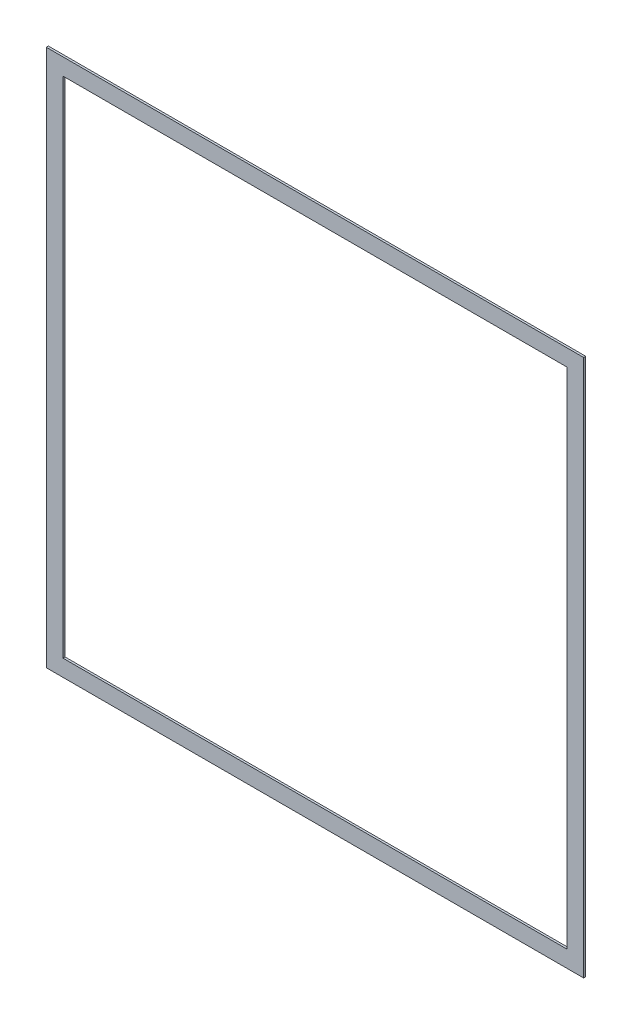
SolidWorks part; units mm, degrees
ref_plane "Front Plane" through (0, 0, 0) normal (0, 0, 1) x (1, 0, 0)
ref_plane "Top Plane" through (0, 0, 0) normal (0, 1, 0) x (1, 0, 0)
ref_plane "Right Plane" through (0, 0, 0) normal (1, 0, 0) x (0, 0, -1)
sketch "Sketch1" plane through (0, 0, 0) normal (0, 0, 1) x (1, 0, 0)
  line L0 (-384.175, 384.175) -> (384.175, 384.175)
  line L1 (-409.575, -409.575) -> (409.575, -409.575)
  line L2 (-409.575, -409.575) -> (-409.575, 409.575)
  line L3 (-409.575, 409.575) -> (409.575, 409.575)
  line L4 (409.575, -409.575) -> (409.575, 409.575)
  line L5 (-409.575, -409.575) -> (409.575, 409.575) construction
  line L6 (-409.575, 409.575) -> (409.575, -409.575) construction
  line L7 (384.175, -384.175) -> (384.175, 384.175)
  line L8 (-384.175, -384.175) -> (384.175, -384.175)
  line L9 (-384.175, -384.175) -> (-384.175, 384.175)
  point P0 (0, 0)
  dimension "D1" = 819.15
  dimension "D2" = 819.15
  dimension "D3" = 25.4
extrude "Extrude1" add sketch "Sketch1" along normal mid plane 3.175
